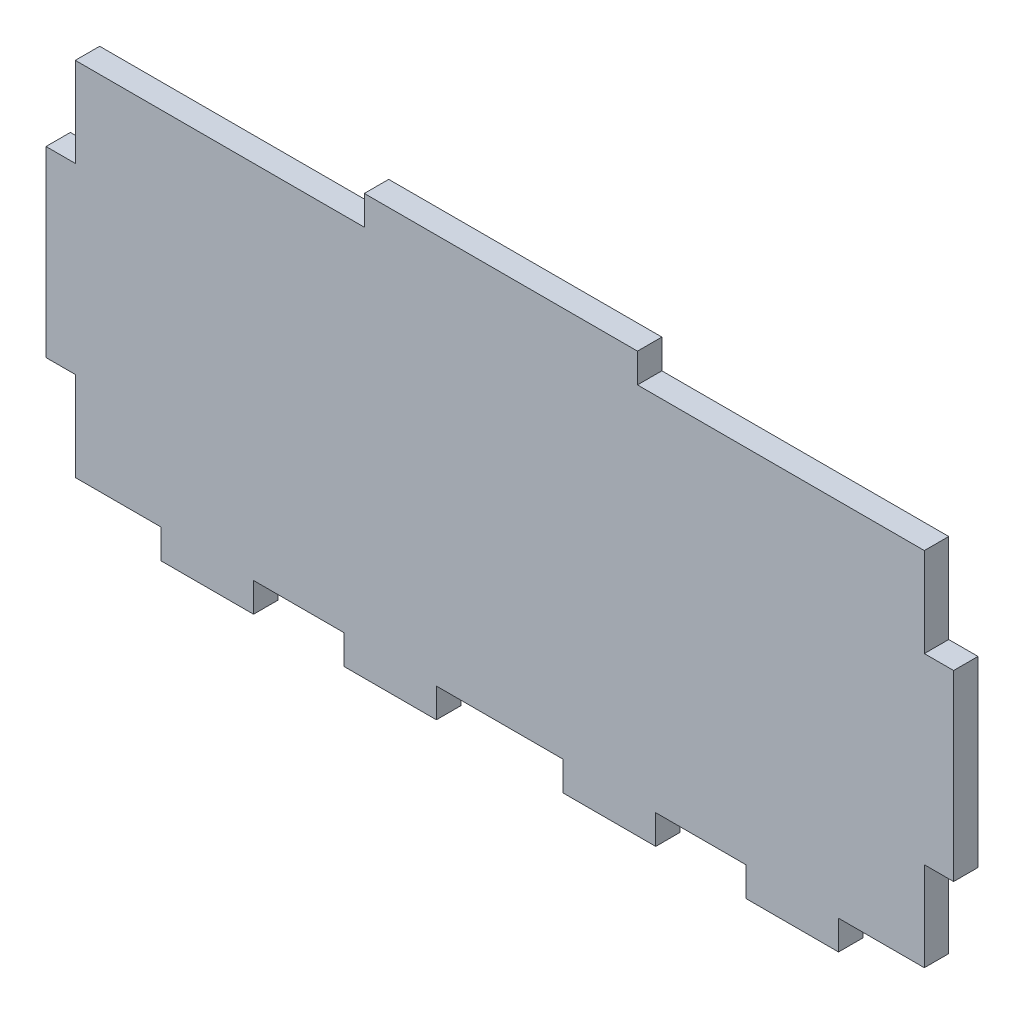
SolidWorks part; units mm, degrees
ref_plane "Alzado" through (0, 0, 0) normal (0, 0, 1) x (1, 0, 0)
ref_plane "Planta" through (0, 0, 0) normal (0, 1, 0) x (1, 0, 0)
ref_plane "Vista lateral" through (0, 0, 0) normal (1, 0, 0) x (0, 0, -1)
sketch "Sketch1" plane through (0, 0, 0) normal (0, 0, 1) x (1, 0, 0)
  line L0 (0, 23.24) -> (0, -20) construction
  line L1 (47, -20) -> (37.5, -20)
  line L2 (47, -20) -> (47, -10.12)
  line L3 (47, 20) -> (15.24, 20)
  line L4 (-47, -20) -> (-47, -10.12)
  line L5 (47, -20) -> (-47, 20) construction
  line L6 (47, 20) -> (-47, -20) construction
  line L7 (-47, 10.12) -> (-50.24, 10.12)
  line L9 (-47, -10.12) -> (-50.24, -10.12)
  line L10 (-50.24, 10.12) -> (-50.24, -10.12)
  line L11 (47, 10.12) -> (50.24, 10.12)
  line L12 (47, -10.12) -> (50.24, -10.12)
  line L13 (50.24, 10.12) -> (50.24, -10.12)
  line L14 (-47, 10.12) -> (-47, 20)
  line L15 (47, 10.12) -> (47, 20)
  line L16 (7.02, -20) -> (7.02, -23.24)
  line L18 (-37.5, -20) -> (-37.5, -23.24)
  line L19 (-37.5, -23.24) -> (-27.26, -23.24)
  line L20 (-27.26, -20) -> (-27.26, -23.24)
  line L22 (-17.26, -20) -> (-17.26, -23.24)
  line L23 (-17.26, -23.24) -> (-7.02, -23.24)
  line L24 (-7.02, -20) -> (-7.02, -23.24)
  line L25 (17.26, -23.24) -> (7.02, -23.24)
  line L26 (17.26, -20) -> (17.26, -23.24)
  line L27 (27.26, -20) -> (27.26, -23.24)
  line L28 (37.5, -23.24) -> (27.26, -23.24)
  line L29 (37.5, -20) -> (37.5, -23.24)
  line L30 (-37.5, -20) -> (-47, -20)
  line L31 (-17.26, -20) -> (-27.26, -20)
  line L32 (7.02, -20) -> (-7.02, -20)
  line L33 (27.26, -20) -> (17.26, -20)
  line L34 (-15, 20) -> (-47, 20)
  line L36 (-15, 20) -> (-15, 23.24)
  line L37 (-15, 23.24) -> (15.24, 23.24)
  line L38 (15.24, 20) -> (15.24, 23.24)
  point P0 (0, 0)
  point P10 (0, 0)
  point P36 (-15, 21.62)
extrude "Boss-Extrude1" add sketch "Sketch1" along normal blind 2.7
equation "\"kerf\"= 0.24"
equation "\"mwk\"= \"mw\" + \"kerf\""
equation "\"D1@Sketch1\"=100.00-(\"mw\"*2)"
equation "\"D4@Sketch1\"=(40-(20+\"kerf\"))/2"
equation "\"D7@Sketch1\"=\"mwk\""
equation "\"D10@Sketch1\"=10+\"kerf\""
equation "\"D9@Sketch1\"=10+\"kerf\""
equation "\"D14@Sketch1\"=\"mwk\""
equation "\"D5@Sketch1\"=\"mwk\""
equation "\"D3@Sketch1\"=20+\"kerf\""
equation "\"mw\"= 3"
equation "\"D8@Sketch1\"=\"mwk\""
equation "\"D12@Sketch1\"=30+\"kerf\""
